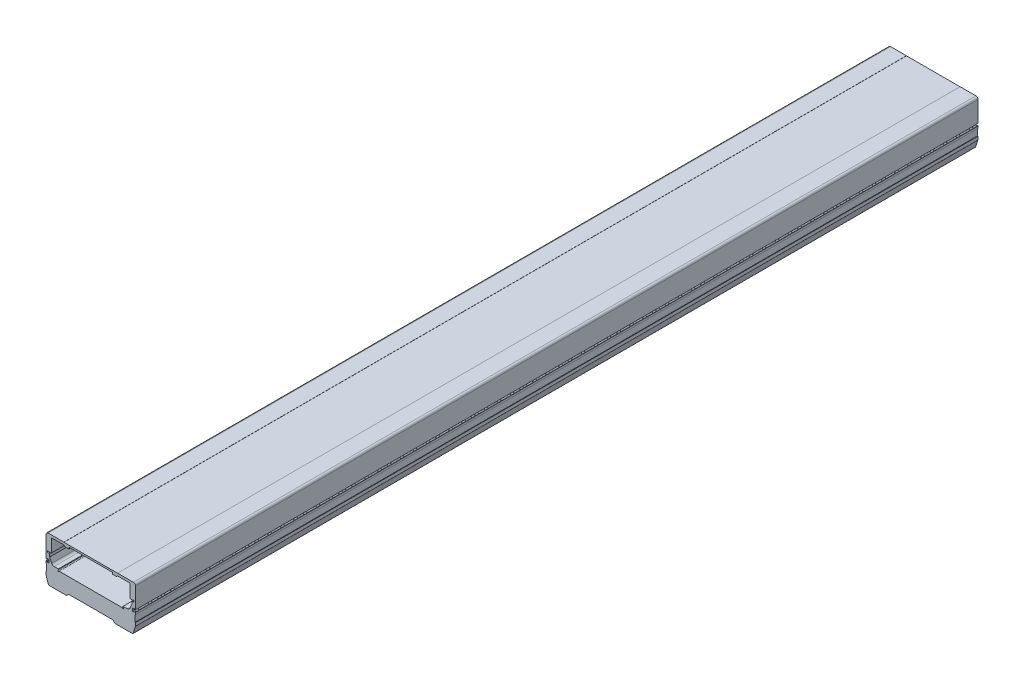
SolidWorks part; units mm, degrees
ref_plane "前视基准面" through (0, 0, 0) normal (0, 0, 1) x (1, 0, 0)
ref_plane "上视基准面" through (0, 0, 0) normal (0, 1, 0) x (1, 0, 0)
ref_plane "右视基准面" through (0, 0, 0) normal (1, 0, 0) x (0, 0, -1)
sketch "草图1" plane through (0, 0, 0) normal (0, 0, 1) x (1, 0, 0)
  line B0 (-85, 77.3) -> (-85, 37.9)
  line B1 (-84.7, 37.6) -> (-83.3, 37.6)
  line B2 (-83, 37.9) -> (-83, 38.4)
  line B3 (-82.7, 38.7) -> (-80.2, 38.7)
  line B4 (-79.2, 37.7) -> (-79.2, 33.9)
  line B5 (-80.2, 32.9) -> (-82.7, 32.9)
  line B6 (-83, 33.2) -> (-83, 33.7)
  line B7 (-83.3, 34) -> (-84.7, 34)
  line B8 (-85, 33.7) -> (-85, 29.8)
  line B9 (-85, 29.8) -> (-84.5, 29.3)
  line B10 (-84.5, 29.3) -> (-84.5, 17.3)
  line B11 (-84.5, 17.3) -> (-85, 16.8)
  line B12 (-85, 16.8) -> (-85, 10.8623)
  line B13 (-84.9487, 10.546) -> (-80.3279, -3.3162)
  line B14 (-79.3792, -4) -> (-46, -4)
  line B15 (-46, -4) -> (-42, 0)
  line B16 (-42, 0) -> (42, 0)
  line B17 (42, 0) -> (46, -4)
  line B18 (46, -4) -> (79.3792, -4)
  line B19 (80.3279, -3.3162) -> (84.9487, 10.546)
  line B20 (85, 10.8623) -> (85, 16.8)
  line B21 (85, 16.8) -> (84.5, 17.3)
  line B22 (84.5, 17.3) -> (84.5, 29.3)
  line B23 (84.5, 29.3) -> (85, 29.8)
  line B24 (85, 29.8) -> (85, 33.7)
  line B25 (84.7, 34) -> (83.3, 34)
  line B26 (83, 33.7) -> (83, 33.2)
  line B27 (82.7, 32.9) -> (80.2, 32.9)
  line B28 (79.2, 33.9) -> (79.2, 37.7)
  line B29 (80.2, 38.7) -> (82.7, 38.7)
  line B30 (83, 38.4) -> (83, 37.9)
  line B31 (83.3, 37.6) -> (84.7, 37.6)
  line B32 (85, 37.9) -> (85, 77.3)
  line B33 (81, 81.3) -> (51, 81.3)
  line B34 (51, 81.3) -> (50.869, 81.169)
  line B35 (50.869, 81.169) -> (-50.869, 81.169)
  line B36 (-50.869, 81.169) -> (-51, 81.3)
  line B37 (-51, 81.3) -> (-81, 81.3)
  line B38 (-41, 77.8) -> (-41, 75.1)
  line B39 (41, 77.8) -> (-41, 77.8)
  line B40 (41, 75.1) -> (41, 77.8)
  line B41 (49, 74.8) -> (41.3, 74.8)
  line B42 (51, 76.8) -> (49, 74.8)
  line B43 (74, 76.8) -> (51, 76.8)
  line B44 (75, 51.3) -> (75, 75.8)
  line B45 (79.6876, 51.3) -> (75, 51.3)
  line B46 (78.1, 49.3) -> (79.6876, 49.3)
  line B47 (78.1, 43.3) -> (78.1, 49.3)
  line B48 (74.1769, 34.8869) -> (78.1, 43.3)
  line B49 (61.5, 32) -> (69.6454, 32)
  line B50 (61.5, 30.4142) -> (61.5, 32)
  line B51 (62.2071, 29.7071) -> (61.5, 30.4142)
  line B52 (60.0858, 29) -> (60.7929, 28.2929)
  line B53 (-60.0858, 29) -> (60.0858, 29)
  line B54 (-60.7929, 28.2929) -> (-60.0858, 29)
  line B55 (-61.5, 30.4142) -> (-62.2071, 29.7071)
  line B56 (-61.5, 32) -> (-61.5, 30.4142)
  line B57 (-69.6454, 32) -> (-61.5, 32)
  line B58 (-78.1, 43.3) -> (-74.1769, 34.8869)
  line B59 (-78.1, 49.3) -> (-78.1, 43.3)
  line B60 (-79.6876, 49.3) -> (-78.1, 49.3)
  line B61 (-75, 51.3) -> (-79.6876, 51.3)
  line B62 (-75, 75.8) -> (-75, 51.3)
  line B63 (-51, 76.8) -> (-74, 76.8)
  line B64 (-49, 74.8) -> (-51, 76.8)
  line B65 (-41.3, 74.8) -> (-49, 74.8)
  arc B66 (-41.3, 74.8) -> (-41, 75.1) centre (-41.3, 75.1) ccw
  arc B67 (41, 75.1) -> (41.3, 74.8) centre (41.3, 75.1) ccw
  arc B68 (-81, 81.3) -> (-85, 77.3) centre (-81, 77.3) ccw
  arc B69 (-85, 37.9) -> (-84.7, 37.6) centre (-84.7, 37.9) ccw
  arc B70 (-83.3, 37.6) -> (-83, 37.9) centre (-83.3, 37.9) ccw
  arc B71 (-82.7, 38.7) -> (-83, 38.4) centre (-82.7, 38.4) ccw
  arc B72 (-79.2, 37.7) -> (-80.2, 38.7) centre (-80.2, 37.7) ccw
  arc B73 (-80.2, 32.9) -> (-79.2, 33.9) centre (-80.2, 33.9) ccw
  arc B74 (-83, 33.2) -> (-82.7, 32.9) centre (-82.7, 33.2) ccw
  arc B75 (-83, 33.7) -> (-83.3, 34) centre (-83.3, 33.7) ccw
  arc B76 (-84.7, 34) -> (-85, 33.7) centre (-84.7, 33.7) ccw
  arc B77 (-85, 10.8623) -> (-84.9487, 10.546) centre (-84, 10.8623) ccw
  arc B78 (-80.3279, -3.3162) -> (-79.3792, -4) centre (-79.3792, -3) ccw
  arc B79 (79.3792, -4) -> (80.3279, -3.3162) centre (79.3792, -3) ccw
  arc B80 (84.9487, 10.546) -> (85, 10.8623) centre (84, 10.8623) ccw
  arc B81 (85, 33.7) -> (84.7, 34) centre (84.7, 33.7) ccw
  arc B82 (83.3, 34) -> (83, 33.7) centre (83.3, 33.7) ccw
  arc B83 (82.7, 32.9) -> (83, 33.2) centre (82.7, 33.2) ccw
  arc B84 (79.2, 33.9) -> (80.2, 32.9) centre (80.2, 33.9) ccw
  arc B85 (80.2, 38.7) -> (79.2, 37.7) centre (80.2, 37.7) ccw
  arc B86 (83, 38.4) -> (82.7, 38.7) centre (82.7, 38.4) ccw
  arc B87 (83, 37.9) -> (83.3, 37.6) centre (83.3, 37.9) ccw
  arc B88 (84.7, 37.6) -> (85, 37.9) centre (84.7, 37.9) ccw
  arc B89 (85, 77.3) -> (81, 81.3) centre (81, 77.3) ccw
  arc B90 (75, 75.8) -> (74, 76.8) centre (74, 75.8) ccw
  arc B91 (79.6876, 49.3) -> (79.6876, 51.3) centre (81, 50.3) ccw
  arc B92 (69.6454, 32) -> (74.1769, 34.8869) centre (69.6454, 37) ccw
  arc B93 (60.7929, 28.2929) -> (62.2071, 29.7071) centre (61.5, 29) ccw
  arc B94 (-62.2071, 29.7071) -> (-60.7929, 28.2929) centre (-61.5, 29) ccw
  arc B95 (-74.1769, 34.8869) -> (-69.6454, 32) centre (-69.6454, 37) ccw
  arc B96 (-79.6876, 51.3) -> (-79.6876, 49.3) centre (-81, 50.3) ccw
  arc B97 (-74, 76.8) -> (-75, 75.8) centre (-74, 75.8) ccw
sketch_block_instance "块1-1"
sketch_block "块1"
extrude "凸台-拉伸1" add sketch "草图1" against normal blind 1601
hole_wizard "M8 螺纹孔" positions "草图5" profile "草图6" tap size "M8" standard "GB"
sketch "草图5" plane through (0, -4, 0) normal (0, -1, 0) x (-1, 0, 0)
  line L6 (0, 1601) -> (0, 1237.2993) construction
  line L10 (79.3792, 1601) -> (46, 1601) construction
  line L11 (42, 1601) -> (-42, 1601) construction
  point P0 (70, 1542.5)
  point P2 (-70, 1542.5)
  point P12 (70, 1392.5)
  point P14 (-70, 1392.5)
  point P19 (-70, 1192.5)
  point P21 (70, 1192.5)
  point P23 (-70, 992.5)
  point P25 (70, 992.5)
  point P27 (-70, 792.5)
  point P29 (70, 792.5)
  point P31 (-70, 592.5)
  point P33 (70, 592.5)
  point P36 (70, 392.5)
  point P38 (-70, 392.5)
  point P58 (-70, 192.5)
  point P60 (-70, -7.5)
  point P62 (70, -7.5)
  point P64 (70, 192.5)
  dimension "D1" = 58.5
  dimension "D2" = 150
  dimension "D3" = 200
  dimension "D4" = 200
  dimension "D5" = 200
  dimension "D6" = 200
  dimension "D7" = 200
  dimension "D8" = 140
  dimension "D9" = 200
  dimension "D10" = 200
sketch "草图6" plane through (-70, -4, -1542.5) normal (1, 0, 0) x (0, 0, -1)
  line L0 (0, 0) -> (0, 21.7929)
  line L1 (0, 21.7929) -> (3.4, 19.75)
  line L2 (3.4, 19.75) -> (3.4, 0)
  line L5 (3.4, 0) -> (0, 0)
  line L10 (0, 21.7929) -> (-3.4, 19.75) construction
  line L11 (0, -6.35) -> (0, 107.95) construction
  dimension "螺纹孔钻头直径" = 6.8
  dimension "螺纹孔钻头深度" = 19.75
  dimension "导头角度" = 118
